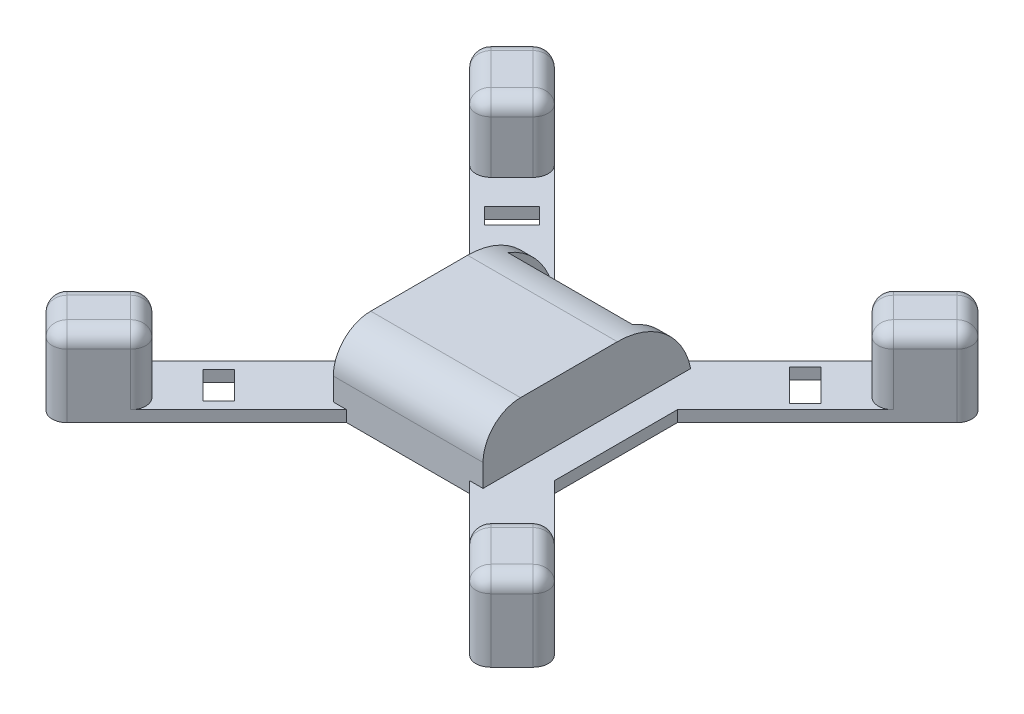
SolidWorks part; units mm, degrees
ref_plane "Alzado" through (0, 0, 0) normal (0, 0, 1) x (1, 0, 0)
ref_plane "Planta" through (0, 0, 0) normal (0, 1, 0) x (1, 0, 0)
ref_plane "Vista lateral" through (0, 0, 0) normal (1, 0, 0) x (0, 0, -1)
sketch "Croquis1" plane through (0, 0, 0) normal (0, 1, 0) x (1, 0, 0)
  line L0 (0, 0) -> (0, 8.2081)
  line L1 (28.2843, -33.9411) -> (33.9411, -28.2843)
  line L2 (0, 0) -> (6.414, 0)
  line L3 (-33.9411, 28.2843) -> (-28.2843, 33.9411)
  line L4 (-33.9411, -28.2843) -> (-13.865, -8.2081)
  line L5 (-13.865, -8.2081) -> (-13.865, 8.2081)
  line L6 (-33.9411, 28.2843) -> (-13.865, 8.2081)
  line L7 (28.2843, -33.9411) -> (8.2081, -13.865)
  line L8 (8.2081, -13.865) -> (-8.2081, -13.865)
  line L9 (-28.2843, -33.9411) -> (-8.2081, -13.865)
  line L13 (-33.9411, -28.2843) -> (-28.2843, -33.9411)
  line L15 (28.2843, 33.9411) -> (33.9411, 28.2843)
  line L22 (-28.2843, 33.9411) -> (-8.2081, 13.865)
  line L23 (28.2843, 33.9411) -> (8.2081, 13.865)
  line L24 (8.2081, 13.865) -> (-8.2081, 13.865)
  line L25 (33.9411, 28.2843) -> (13.865, 8.2081)
  line L26 (33.9411, -28.2843) -> (13.865, -8.2081)
  line L27 (13.865, -8.2081) -> (13.865, 8.2081)
  circle A0 centre (-27.5772, 27.5772) radius 3
  circle A2 centre (27.5772, -27.5772) radius 3
  circle A3 centre (-27.5772, -27.5772) radius 3
  circle A4 centre (27.5772, 27.5772) radius 3
  point P0 (0, 0)
  point P6 (-13.865, 13.865)
  point P18 (0, 0)
  point P38 (13.865, 13.865)
  point P39 (13.865, -13.865)
  point P40 (-13.865, -13.865)
extrude "Saliente-Extruir1" add sketch "Croquis1" along normal blind 1.5 contours L6 L5 L4 L13 L9 L8 L7 L1 L26 L27 L25 L15 L23 L24 L22 L3
sketch "Croquis2" plane through (0, 1.5, 0) normal (0, 1, 0) x (1, 0, 0)
  line L0 (31.1127, 31.1127) -> (27.5772, 27.5772)
  line L1 (28.2843, 33.9411) -> (33.9411, 28.2843) construction
  line L2 (0, 0) -> (0, 6.7235)
  line L3 (26.8701, 21.2132) -> (33.9411, 28.2843)
  line L4 (26.8701, 21.2132) -> (21.2132, 26.8701)
  line L5 (21.2132, 26.8701) -> (28.2843, 33.9411)
  line L6 (33.9411, 28.2843) -> (28.2843, 33.9411)
  line L7 (26.8701, 21.2132) -> (28.2843, 33.9411) construction
  line L8 (21.2132, 26.8701) -> (33.9411, 28.2843) construction
  line L9 (0, 0) -> (5.2498, 0)
  line L10 (21.2132, -26.8701) -> (33.9411, -28.2843) construction
  line L11 (26.8701, -21.2132) -> (28.2843, -33.9411) construction
  line L12 (33.9411, -28.2843) -> (28.2843, -33.9411)
  line L13 (21.2132, -26.8701) -> (28.2843, -33.9411)
  line L14 (26.8701, -21.2132) -> (21.2132, -26.8701)
  line L15 (26.8701, -21.2132) -> (33.9411, -28.2843)
  line L16 (-21.2132, 26.8701) -> (-33.9411, 28.2843) construction
  line L17 (-26.8701, 21.2132) -> (-28.2843, 33.9411) construction
  line L18 (-33.9411, 28.2843) -> (-28.2843, 33.9411)
  line L19 (-26.8701, 21.2132) -> (-21.2132, 26.8701)
  line L20 (-26.8701, 21.2132) -> (-33.9411, 28.2843)
  line L21 (-21.2132, 26.8701) -> (-28.2843, 33.9411)
  line L22 (-26.8701, -21.2132) -> (-28.2843, -33.9411) construction
  line L23 (-21.2132, -26.8701) -> (-33.9411, -28.2843) construction
  line L24 (-26.8701, -21.2132) -> (-33.9411, -28.2843)
  line L25 (-26.8701, -21.2132) -> (-21.2132, -26.8701)
  line L26 (-21.2132, -26.8701) -> (-28.2843, -33.9411)
  line L27 (-33.9411, -28.2843) -> (-28.2843, -33.9411)
  point P4 (27.5772, 27.5772)
  point P17 (27.5772, -27.5772)
  point P22 (-27.5772, 27.5772)
  point P27 (-27.5772, -27.5772)
extrude "Saliente-Extruir2" add sketch "Croquis2" along normal blind 9
sketch "Croquis3" plane through (0, 1.5, 0) normal (0, 1, 0) x (1, 0, 0)
  line L1 (10, 13.865) -> (-10, 13.865)
  line L2 (10, 13.865) -> (10, -13.865)
  line L3 (10, -13.865) -> (-10, -13.865)
  line L4 (-10, 13.865) -> (-10, -13.865)
  line L5 (10, 13.865) -> (-10, -13.865) construction
  line L6 (10, -13.865) -> (-10, 13.865) construction
  point P0 (0, 0)
extrude "Saliente-Extruir3" add sketch "Croquis3" along normal blind 8
sketch "Croquis4" plane through (0, 0, -13.865) normal (0, 0, -1) x (-1, 0, 0)
  line L0 (0, 1.5) -> (0, 8.768)
  line L3 (-8.35, 1.484) -> (8.35, 1.484)
  line L4 (-8.35, 1.484) -> (-8.35, 8.784)
  line L5 (-8.35, 8.784) -> (8.35, 8.784)
  line L6 (8.35, 1.484) -> (8.35, 8.784)
  line L7 (-8.35, 1.484) -> (8.35, 8.784) construction
  line L8 (-8.35, 8.784) -> (8.35, 1.484) construction
  point P3 (0, 5.134)
extrude "Cortar-Extruir1" cut sketch "Croquis4" against normal blind 25.7 contours L5 L6 L3 L4
fillet "Redondeo1" radius 5 1 edges at (0, 9.5, 13.865)
fillet "Redondeo2" radius 10 1 edges at (0, 9.5, -13.865)
fillet "Redondeo3" radius 2 1 edges at (0, 8.784, 11.835)
fillet "Redondeo4" radius 2 32 edges at (-24.0416, 10.5, 24.0416) (-30.4056, 10.5, 24.7487) (-24.7487, 10.5, 30.4056) (-31.1127, 10.5, 31.1127) (-26.8701, 6, 21.2132) (-21.2132, 6, 26.8701) (-28.2843, 5.25, 33.9411) (-33.9411, 5.25, 28.2843) (-24.0416, 10.5, -24.0416) (-30.4056, 10.5, -24.7487) (-24.7487, 10.5, -30.4056) (-31.1127, 10.5, -31.1127) (-33.9411, 5.25, -28.2843) (-28.2843, 5.25, -33.9411) (26.8701, 6, -21.2132) (21.2132, 6, -26.8701) (30.4056, 10.5, -24.7487) (24.7487, 10.5, -30.4056) (24.0416, 10.5, -24.0416) (31.1127, 10.5, -31.1127) (28.2843, 5.25, -33.9411) (33.9411, 5.25, -28.2843) (30.4056, 10.5, 24.7487) (24.7487, 10.5, 30.4056) (24.0416, 10.5, 24.0416) (31.1127, 10.5, 31.1127) (28.2843, 5.25, 33.9411) (33.9411, 5.25, 28.2843) (21.2132, 6, 26.8701) (26.8701, 6, 21.2132)
sketch "Croquis5" plane through (0, 0, 0) normal (0, -1, 0) x (1, 0, 0)
  line L24 (8.2081, -11.865) -> (-8.2081, -11.865)
  line L25 (8.2081, -11.865) -> (-8.2081, -11.865)
  line L27 (-11.865, 8.2081) -> (-11.865, -8.2081)
  line L28 (-11.865, 8.2081) -> (-11.865, -8.2081)
  line L33 (8.2081, 11.865) -> (-8.2081, 11.865)
  line L34 (8.2081, 11.865) -> (-8.2081, 11.865)
  line L35 (11.865, -8.2081) -> (22.4716, -18.8147)
  line L36 (11.865, 8.2081) -> (11.865, -8.2081)
  line L37 (11.865, 8.2081) -> (11.865, -8.2081)
  line L38 (8.2081, -11.865) -> (18.8147, -22.4716)
  line L39 (18.8147, -22.4716) -> (22.4716, -18.8147)
  line L40 (0, 0) -> (0, -5.2116)
  line L41 (0, 0) -> (-4.5826, 0)
  line L42 (-18.8147, -22.4716) -> (-22.4716, -18.8147)
  line L43 (-8.2081, -11.865) -> (-18.8147, -22.4716)
  line L44 (-11.865, -8.2081) -> (-22.4716, -18.8147)
  line L45 (18.8147, 22.4716) -> (22.4716, 18.8147)
  line L46 (8.2081, 11.865) -> (18.8147, 22.4716)
  line L47 (11.865, 8.2081) -> (22.4716, 18.8147)
  line L48 (-11.865, 8.2081) -> (-22.4716, 18.8147)
  line L49 (-8.2081, 11.865) -> (-18.8147, 22.4716)
  line L50 (-18.8147, 22.4716) -> (-22.4716, 18.8147)
  dimension "D1" = 2
  dimension "D2" = 2
  dimension "D3" = 2
  dimension "D4" = 2
extrude "Cortar-Extruir2" cut sketch "Croquis5" against normal blind 1
sketch "Croquis6" plane through (0, 0, 0) normal (0, -1, 0) x (1, 0, 0)
  line L0 (20.6432, -20.6432) -> (18.5219, -18.5219)
  line L1 (18.8147, -22.4716) -> (22.4716, -18.8147) construction
  line L2 (0, 0) -> (6.3319, 0)
  line L3 (20.6432, -16.4005) -> (22.7645, -18.5219)
  line L4 (20.6432, -16.4005) -> (16.4005, -20.6432)
  line L5 (16.4005, -20.6432) -> (18.5219, -22.7645)
  line L6 (22.7645, -18.5219) -> (18.5219, -22.7645)
  line L7 (20.6432, -16.4005) -> (18.5219, -22.7645) construction
  line L8 (16.4005, -20.6432) -> (22.7645, -18.5219) construction
  line L9 (0, 0) -> (0, -3.6898)
  line L10 (20.6432, 16.4005) -> (22.7645, 18.5219)
  line L11 (22.7645, 18.5219) -> (18.5219, 22.7645)
  line L12 (16.4005, 20.6432) -> (18.5219, 22.7645)
  line L13 (20.6432, 16.4005) -> (16.4005, 20.6432)
  line L14 (-20.6432, 16.4005) -> (-16.4005, 20.6432)
  line L15 (-16.4005, 20.6432) -> (-18.5219, 22.7645)
  line L16 (-22.7645, 18.5219) -> (-18.5219, 22.7645)
  line L17 (-20.6432, 16.4005) -> (-22.7645, 18.5219)
  line L18 (-16.4005, -20.6432) -> (-22.7645, -18.5219) construction
  line L19 (-20.6432, -16.4005) -> (-18.5219, -22.7645) construction
  line L20 (-22.7645, -18.5219) -> (-18.5219, -22.7645)
  line L21 (-16.4005, -20.6432) -> (-18.5219, -22.7645)
  line L22 (-20.6432, -16.4005) -> (-16.4005, -20.6432)
  line L23 (-20.6432, -16.4005) -> (-22.7645, -18.5219)
  line L24 (-20.6432, -20.6432) -> (-18.5219, -18.5219)
  line L25 (31.1127, -31.1127) -> (27.5772, -27.5772)
  line L26 (29.6985, -32.5269) -> (32.5269, -29.6985) construction
  circle A0 centre (27.5772, -27.5772) radius 3.05
  circle A1 centre (27.5772, 27.5772) radius 3.05
  circle A2 centre (-27.5772, 27.5772) radius 3.05
  circle A3 centre (-27.5772, -27.5772) radius 3.05
  point P4 (19.5825, -19.5825)
  point P27 (-19.5825, -19.5825)
extrude "Cortar-Extruir3" cut sketch "Croquis6" against normal blind 8
